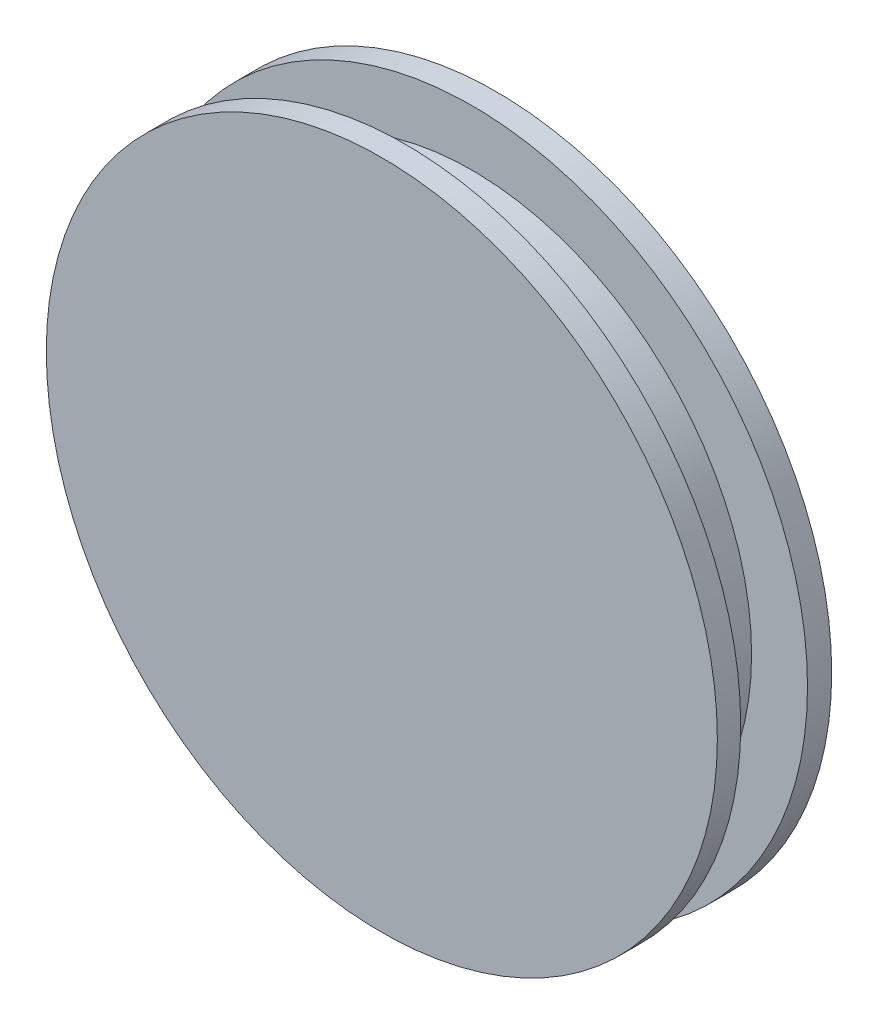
SolidWorks part; units mm, degrees
ref_plane "Front Plane" through (0, 0, 0) normal (0, 0, 1) x (1, 0, 0)
ref_plane "Top Plane" through (0, 0, 0) normal (0, 1, 0) x (1, 0, 0)
ref_plane "Right Plane" through (0, 0, 0) normal (1, 0, 0) x (0, 0, -1)
sketch "Sketch1" plane through (0, 0, 0) normal (0, 0, 1) x (1, 0, 0)
  circle A0 centre (0, 0) radius 10.2108
  dimension "D1" = 20.4216
extrude "Extrude1" add sketch "Sketch1" along normal blind 3.4798
ref_plane "Plane1" through (0, 0, 0.7366) normal (0, 0, 1) x (1, 0, 0)
sketch "Sketch2" plane through (0, 0, 0.7366) normal (0, 0, 1) x (1, 0, 0)
  circle A0 centre (0, 0) radius 8.509
  dimension "D1" = 17.018
extrude "Cut-Extrude1" cut sketch "Sketch2" along normal blind 2.032 flip side to cut
